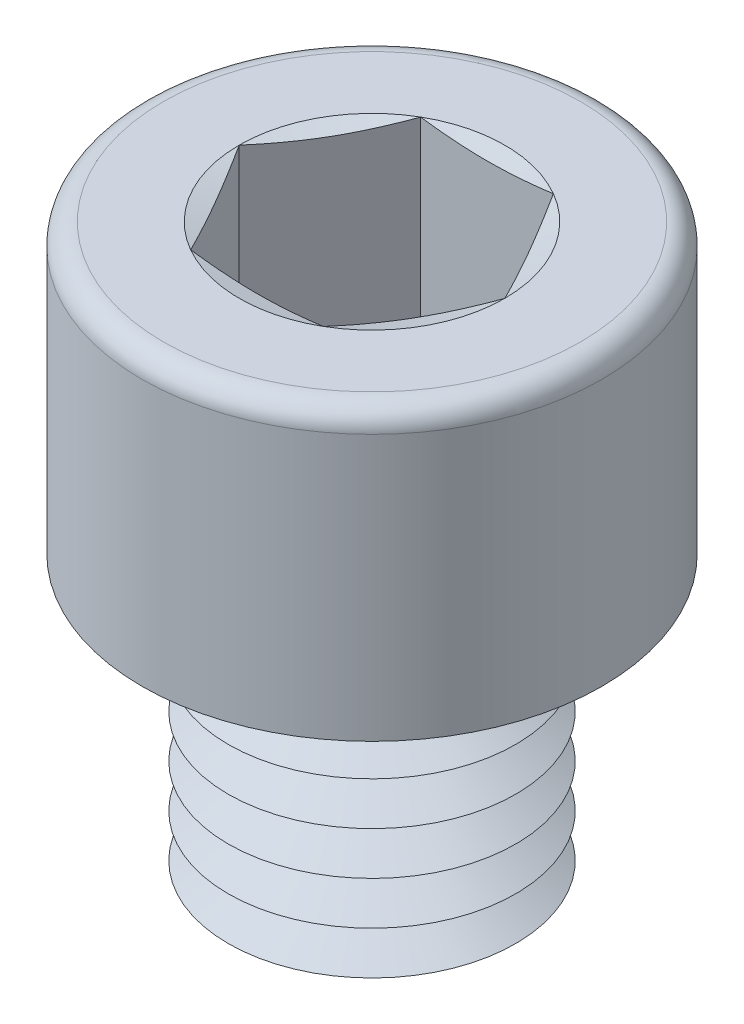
SolidWorks part; units mm, degrees
ref_plane "Front Plane" through (0, 0, 0) normal (0, 0, 1) x (1, 0, 0)
ref_plane "Top Plane" through (0, 0, 0) normal (0, 1, 0) x (1, 0, 0)
ref_plane "Right Plane" through (0, 0, 0) normal (1, 0, 0) x (0, 0, -1)
sketch "Sketch1" plane through (0, 0, 0) normal (0, 1, 0) x (1, 0, 0)
  circle A0 centre (0, 0) radius 5
  dimension "D1" = 10
extrude "Extrude1" add sketch "Sketch1" along normal blind 10
sketch "Sketch2" plane through (0, 10, 0) normal (0, 1, 0) x (1, 0, 0)
  circle A0 centre (0, 0) radius 8
  dimension "D1" = 16
extrude "Extrude2" add sketch "Sketch2" along normal blind 10
sketch "Sketch3" plane through (0, 20, 0) normal (0, 1, 0) x (1, 0, 0)
  line L1 (2.3094, 4) -> (-2.3094, 4)
  line L2 (-2.3094, 4) -> (-4.6188, 0)
  line L3 (-4.6188, 0) -> (-2.3094, -4)
  line L4 (-2.3094, -4) -> (2.3094, -4)
  line L5 (2.3094, -4) -> (4.6188, 0)
  line L6 (4.6188, 0) -> (2.3094, 4)
  circle A0 centre (0, 0) radius 4 construction
  dimension "D1" = 8
extrude "Extrude3" cut sketch "Sketch3" against normal blind 8
fillet "Fillet1" radius 0.75 1 edges at (0, 20, 8)
sketch "Sketch4" plane through (0, 0, 0) normal (1, 0, 0) x (0, 0, -1)
  line L0 (-4, 12) -> (0, 12)
  line L1 (0, 12) -> (0, 9.6906)
  line L2 (0, 9.6906) -> (-4, 12)
  dimension "D1" = 30
revolve "Cut-Revolve1" cut sketch "Sketch4" angle 360 about L1
sketch "Sketch5" plane through (0, 0, 0) normal (0, 0, 1) x (1, 0, 0)
  line L0 (-5, 0.75) -> (-5, -0.75)
  line L1 (-5, 10) -> (-5, 0) construction
  line L2 (-5, -0.75) -> (-3.701, 0)
  line L3 (-5, 0) -> (5, 0) construction
  line L4 (-3.701, 0) -> (-5, 0.75)
  dimension "D1" = 1.5
revolve "Cut-Revolve2" cut sketch "Sketch5" angle 360 about axis through (0, 10, 0) along (0, -1, 0)
pattern_linear "LPattern1" count 7 spacing 1.5 along (0, 1, 0) of "Cut-Revolve2"
sketch "Sketch6" plane through (0, 20, 0) normal (0, 1, 0) x (1, 0, 0)
  circle A0 centre (0, 0) radius 4.6188
extrude "Extrude4" cut sketch "Sketch6" against normal through all draft 75
